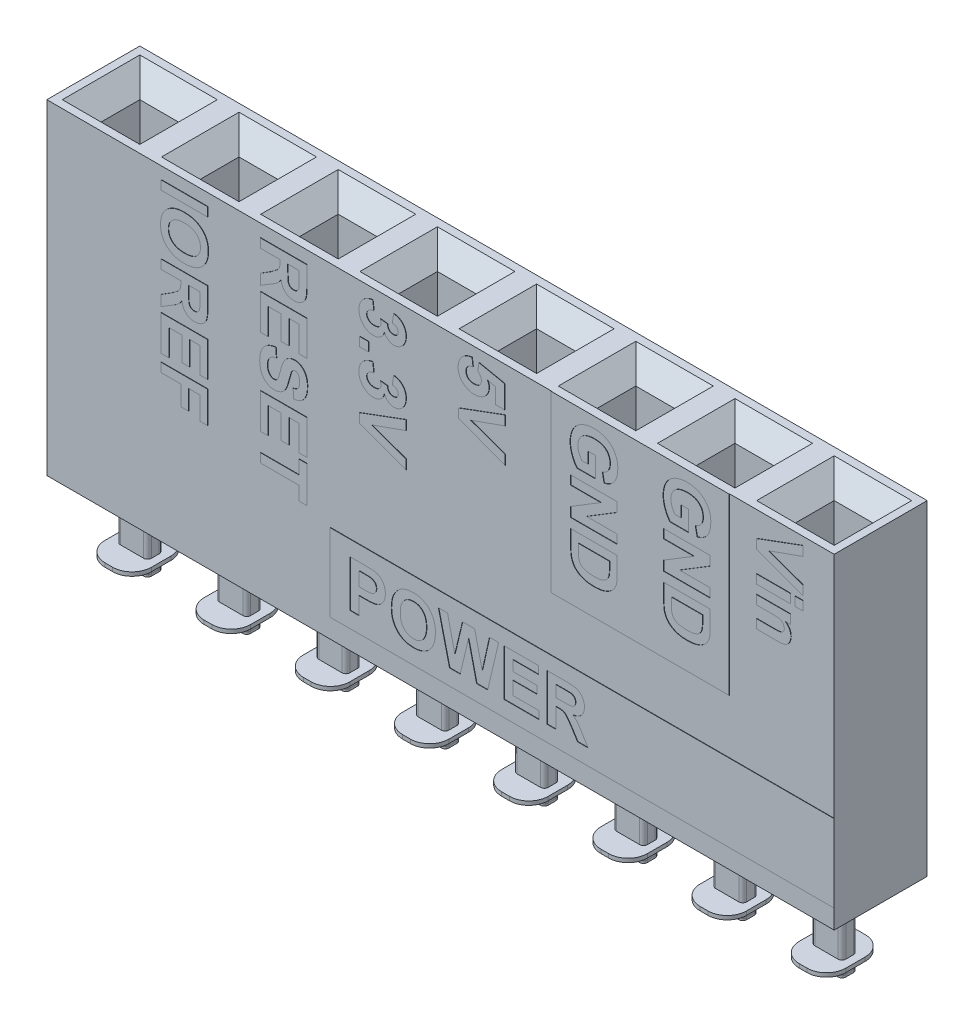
SolidWorks part; units mm, degrees
ref_plane "Plan de face" through (0, 0, 0) normal (0, 0, 1) x (1, 0, 0)
ref_plane "Plan de dessus" through (0, 0, 0) normal (0, 1, 0) x (1, 0, 0)
ref_plane "Plan de droite" through (0, 0, 0) normal (1, 0, 0) x (0, 0, -1)
sketch "Esquisse1" plane through (0, 0, 0) normal (0, 1, 0) x (1, 0, 0)
  line L1 (0, 0) -> (20.32, 0)
  line L2 (0, 0) -> (0, 2.4)
  line L3 (0, 2.4) -> (20.32, 2.4)
  line L4 (20.32, 0) -> (20.32, 2.4)
  dimension "D1" = 20.32
  dimension "D2" = 2.4
extrude "Boss.-Extru.1" add sketch "Esquisse1" along normal blind 8.4
sketch "Esquisse2" plane through (0, 8.4, 0) normal (0, 1, 0) x (1, 0, 0)
  line L0 (0, 0) -> (20.32, 0) construction
  line L1 (0.7, 0.7) -> (1.7, 0.7)
  line L2 (0.7, 0.7) -> (0.7, 1.7)
  line L3 (0.7, 1.7) -> (1.7, 1.7)
  line L4 (1.7, 0.7) -> (1.7, 1.7)
  line L5 (0, 2.4) -> (0, 0) construction
  dimension "D1" = 1
  dimension "D2" = 1
  dimension "D3" = 0.7
  dimension "D4" = 0.7
extrude "Enlèv. mat.-Extru.1" cut sketch "Esquisse2" against normal blind 2
chamfer "Chanfrein2" distance 0.5 angle 45 4 edges at (1.2, 8.4, -0.7) (1.7, 8.4, -1.2) (1.2, 8.4, -1.7) (0.7, 8.4, -1.2)
sketch "Esquisse3" plane through (0, 0, 0) normal (0, -1, 0) x (1, 0, 0)
  line L0 (20.32, -2.4) -> (0, -2.4) construction
  line L1 (0.8, -1) -> (1.6, -1)
  line L2 (0.8, -1) -> (0.8, -1.4)
  line L3 (0.8, -1.4) -> (1.6, -1.4)
  line L4 (1.6, -1) -> (1.6, -1.4)
  line L9 (0, -2.4) -> (0, 0) construction
  dimension "D1" = 0.4
  dimension "D2" = 0.8
  dimension "D7" = 0.8
  dimension "D8" = 1
extrude "Boss.-Extru.2" add sketch "Esquisse3" along normal blind 1.6
sketch "Esquisse5" plane through (0, -1.6, 0) normal (0, -1, 0) x (1, 0, 0)
  line L0 (0, -2.4) -> (0, 0) construction
  line L1 (1.1, -0.4) -> (1.3, -0.4)
  line L2 (0.6, -0.9) -> (0.6, -1.4)
  line L3 (1.1, -1.9) -> (1.3, -1.9)
  line L4 (1.8, -0.9) -> (1.8, -1.4)
  line L5 (20.32, -2.4) -> (0, -2.4) construction
  arc A0 (0.6, -1.4) -> (1.1, -1.9) centre (1.1, -1.4) ccw
  arc A1 (1.3, -1.9) -> (1.8, -1.4) centre (1.3, -1.4) ccw
  arc A2 (1.8, -0.9) -> (1.3, -0.4) centre (1.3, -0.9) ccw
  arc A3 (0.6, -0.9) -> (1.1, -0.4) centre (1.1, -0.9) cw
  point P10 (0.6, -1.9)
  point P15 (1.8, -0.4)
  point P18 (0.6, -0.4)
  dimension "D5" = 0.5
  dimension "D1" = 1.2
  dimension "D2" = 1.5
  dimension "D3" = 0.6
  dimension "D4" = 0.5
extrude "Boss.-Extru.3" add sketch "Esquisse5" along normal blind 0.1
sketch "Esquisse6" plane through (0, -1.7, 0) normal (0, -1, 0) x (1, 0, 0)
  line L1 (0.8, -1) -> (1.6, -1)
  line L2 (0.8, -1) -> (0.8, -1.4)
  line L3 (0.8, -1.4) -> (1.6, -1.4)
  line L4 (1.6, -1) -> (1.6, -1.4)
extrude "Boss.-Extru.4" add sketch "Esquisse6" along normal blind 0.3
fillet "Congé19" radius 0.1 4 edges at (0.8, -1.85, -1) (0.8, -1.85, -1.4) (1.6, -1.85, -1) (1.6, -1.85, -1.4)
fillet "Congé20" radius 0.1 4 edges at (0.8, -0.8, -1) (1.6, -0.8, -1) (1.6, -0.8, -1.4) (0.8, -0.8, -1.4)
fillet "Congé22" radius 0.25 7 edges at (1.5707, -1.7, -1.0293) (1.2, -1.7, -1) (0.8293, -1.7, -1.0293) (0.8, -1.7, -1.2) (1.5707, -1.7, -1.3707) (1.2, -1.7, -1.4) (0.8293, -1.7, -1.3707)
pattern_linear "Répétition linéaire1" count 8 spacing 2.56 along (1, 0, 0) of "Enlèv. mat.-Extru.1", "Chanfrein2"
pattern_linear "Répétition linéaire2" count 8 spacing 2.56 along (1, 0, 0) of "Boss.-Extru.2", "Boss.-Extru.3", "Boss.-Extru.4", "Congé20", "Congé19", "Congé22"
sketch "Esquisse7" plane through (0, 0, 0) normal (0, 0, 1) x (1, 0, 0)
  line L0 (0, 8.4) -> (20.32, 8.4) construction
  line L1 (13.02, 8.4) -> (17.62, 8.4)
  line L2 (13.02, 8.4) -> (13.02, 3.9)
  line L3 (13.02, 3.9) -> (17.62, 3.9)
  line L4 (17.62, 8.4) -> (17.62, 3.9)
  line L5 (20.32, 8.4) -> (20.32, 0) construction
  line L6 (20.32, 2.5) -> (7.32, 2.5)
  line L7 (20.32, 2.5) -> (20.32, 0.5)
  line L8 (20.32, 0.5) -> (7.32, 0.5)
  line L9 (7.32, 2.5) -> (7.32, 0.5)
  line L10 (0, 0) -> (20.32, 0) construction
  line L11 (18.32, 8.2) -> (18.32, 3.3808) construction
  line L12 (10.64, 8.2) -> (10.64, 3.0076) construction
  line L13 (8.08, 8.2) -> (8.08, 3.0076) construction
  line L14 (5.52, 8.2) -> (5.52, 3.0076) construction
  line L15 (2.96, 8.2) -> (2.96, 3.0076) construction
  text T0 "Vin" font "Arial" height 1.2
  text T1 "5V" font "Arial" height 1.2
  text T2 "3.3V" font "Arial" height 1.2
  text T3 "RESET" font "Arial" height 1.2
  text T4 "IOREF" font "Arial" height 1.2
  dimension "D1" = 4.5
  dimension "D2" = 0.5
  dimension "D3" = 2
  dimension "D4" = 13
  dimension "D5" = 2.7
  dimension "D6" = 4.6
  dimension "D7" = 2.56
  dimension "D8" = 2.56
  dimension "D9" = 2.56
  dimension "D10" = 7.68
  dimension "D11" = 2
  dimension "D12" = 0.2
extrude "Boss.-Extru.5" add sketch "Esquisse7" along normal blind 0.01
sketch "Esquisse8" plane through (0, 0, 0.01) normal (0, 0, 1) x (1, 0, 0)
  line L0 (15.9303, 8.2) -> (15.9303, 4.187) construction
  line L1 (13.5303, 8.2) -> (13.5303, 4.187) construction
  line L2 (17.62, 8.4) -> (13.02, 8.4) construction
  line L3 (7.7159, 0.9067) -> (12.9667, 0.9067) construction
  text T0 "GND" font "Arial" height 1.2
  text T1 "GND" font "Arial" height 1.2
  text T2 "POWER" font "Arial" height 1.2
  dimension "D1" = 2.4
  dimension "D2" = 0.2
extrude "Enlèv. mat.-Extru.2" cut sketch "Esquisse8" against normal blind 0.01
